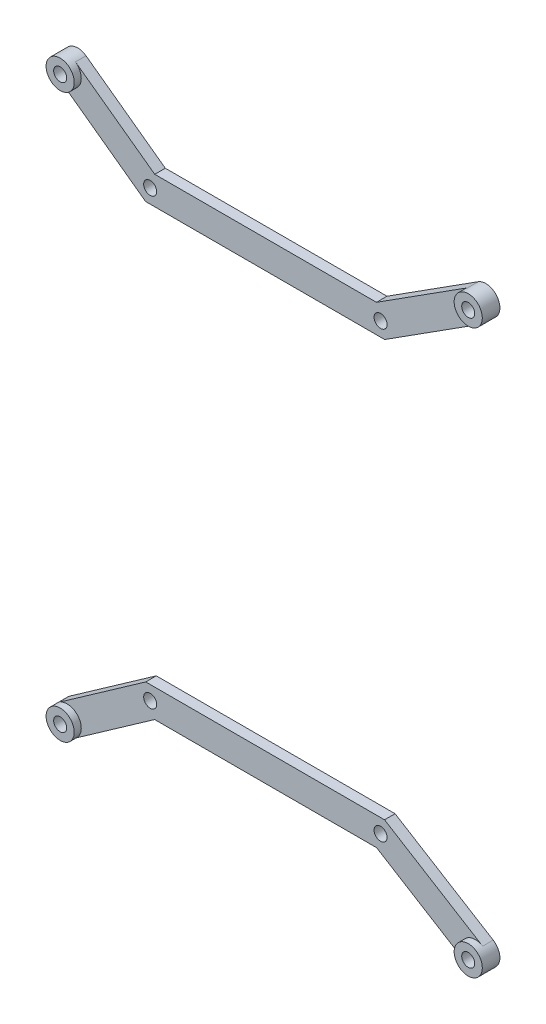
SolidWorks part; units mm, degrees
ref_plane "Ebene vorne" through (0, 0, 0) normal (0, 0, 1) x (1, 0, 0)
ref_plane "Ebene oben" through (0, 0, 0) normal (0, 1, 0) x (1, 0, 0)
ref_plane "Ebene rechts" through (0, 0, 0) normal (1, 0, 0) x (0, 0, -1)
sketch "Skizze1" plane through (0, 0, 0) normal (0, 0, 1) x (1, 0, 0)
  line L5 (60.7316, -75.2347) -> (32.8462, -58.06)
  line L19 (32.8462, -58.06) -> (30.5802, -66.06) construction
  line L20 (-32.5116, -66.06) -> (-35.0419, -58.06) construction
  line L26 (-32.4752, 68.19) -> (-35.0783, 60.19) construction
  line L27 (32.8462, -58.06) -> (-35.0419, -58.06)
  line L28 (-35.0419, -58.06) -> (-59.6663, -75.3681)
  line L29 (-55.0659, -81.913) -> (-32.5116, -66.06)
  line L30 (-32.5116, -66.06) -> (30.5802, -66.06)
  line L31 (30.5802, -66.06) -> (56.5363, -82.0464)
  line L32 (32.8802, 60.19) -> (30.5462, 68.19) construction
  line L33 (30.5462, 68.19) -> (56.483, 84.7319)
  line L34 (-32.4752, 68.19) -> (30.5462, 68.19)
  line L35 (-55.0122, 84.5935) -> (-32.4752, 68.19)
  line L36 (-35.0783, 60.19) -> (-59.72, 78.1254)
  line L37 (32.8802, 60.19) -> (-35.0783, 60.19)
  line L38 (60.7848, 77.987) -> (32.8802, 60.19)
  arc A0 (-59.6663, -75.3681) -> (-55.0659, -81.913) centre (-57.3661, -78.6405) ccw
  arc A1 (56.5363, -82.0464) -> (60.7316, -75.2347) centre (58.6339, -78.6405) ccw
  arc A2 (34.4632, -62.06) -> (28.9632, -62.06) centre (31.7132, -62.06) ccw construction
  arc A3 (-31.0268, -62.06) -> (-36.5268, -62.06) centre (-33.7768, -62.06) ccw construction
  circle A4 centre (-33.7768, -62.06) radius 1.85
  circle A5 centre (31.7132, -62.06) radius 1.85
  circle A6 centre (31.7132, 64.19) radius 1.85
  circle A7 centre (-33.7768, 64.19) radius 1.85
  arc A8 (56.483, 84.7319) -> (60.7848, 77.987) centre (58.6339, 81.3595) cw
  arc A9 (-59.72, 78.1254) -> (-55.0122, 84.5935) centre (-57.3661, 81.3595) cw
  circle A10 centre (-57.3661, 81.3595) radius 1.85
  circle A11 centre (58.6339, 81.3595) radius 1.85
  circle A12 centre (58.6339, -78.6405) radius 1.85
  circle A13 centre (-57.3661, -78.6405) radius 1.85
  point P1 (31.7132, -62.06)
  point P5 (-33.7768, -62.06)
  point P25 (46.7889, -66.6473)
extrude "Aufsatz-Linear austragen1" add sketch "Skizze1" against normal blind 3
sketch "Skizze5" plane through (0, 0, 0) normal (0, 0, 1) x (1, 0, 0)
  circle A0 centre (-57.3661, -78.6405) radius 4
  circle A1 centre (58.6339, -78.6405) radius 4
  arc A2 (56.5363, -82.0464) -> (60.7316, -75.2347) centre (58.6339, -78.6405) ccw construction
  arc A3 (-59.6663, -75.3681) -> (-55.0659, -81.913) centre (-57.3661, -78.6405) ccw construction
  circle A4 centre (-57.3661, 81.3595) radius 4
  circle A5 centre (58.6339, 81.3595) radius 4
  arc A6 (60.7848, 77.987) -> (56.483, 84.7319) centre (58.6339, 81.3595) ccw construction
  arc A7 (-55.0122, 84.5935) -> (-59.72, 78.1254) centre (-57.3661, 81.3595) ccw construction
  circle A8 centre (-57.3661, 81.3595) radius 1.85
  circle A9 centre (58.6339, 81.3595) radius 1.85
  circle A10 centre (58.6339, -78.6405) radius 1.85
  circle A11 centre (-57.3661, -78.6405) radius 1.85
  circle A12 centre (-57.3661, 81.3595) radius 1.85 construction
  circle A13 centre (58.6339, 81.3595) radius 1.85 construction
  circle A14 centre (58.6339, -78.6405) radius 1.85 construction
  circle A15 centre (-57.3661, -78.6405) radius 1.85 construction
extrude "Aufsatz-Linear austragen2" add sketch "Skizze5" along normal blind 2
equation "\"D5@Skizze1\"=\"D6@Skizze1\""
equation "\"D7@Skizze1\"=\"D6@Skizze1\""
equation "\"D4@Skizze1\"=\"D6@Skizze1\""
equation "\"D1@Skizze1\"=\"D6@Skizze1\""
equation "\"D3@Skizze1\"=\"D6@Skizze1\""
